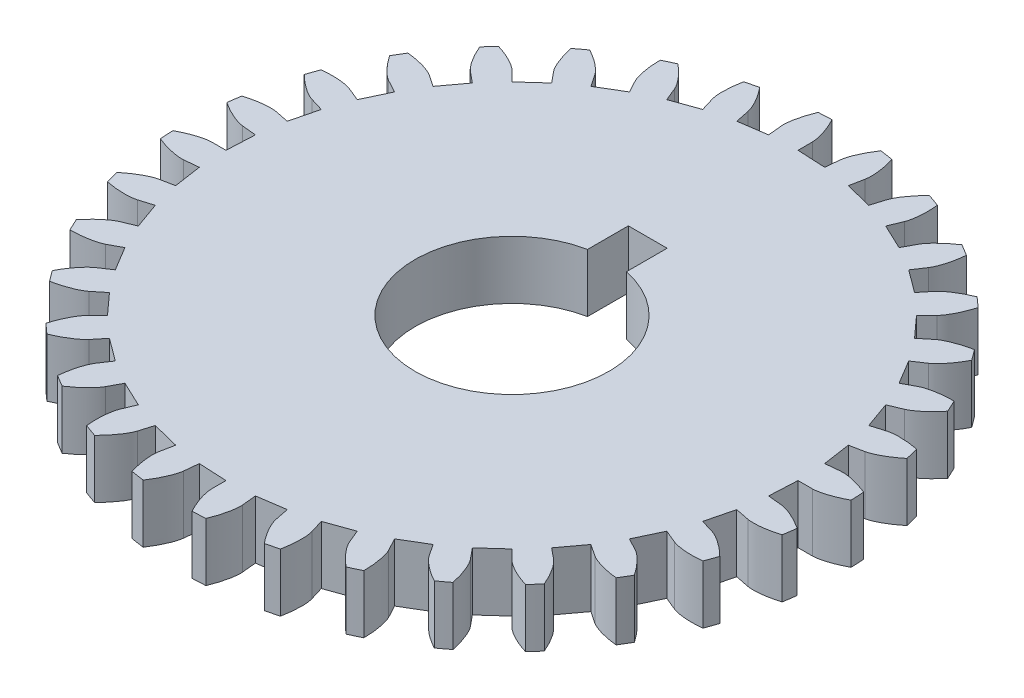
SolidWorks part; units mm, degrees
ref_plane "Front Plane" through (0, 0, 0) normal (0, 0, 1) x (1, 0, 0)
ref_plane "Top Plane" through (0, 0, 0) normal (0, 1, 0) x (1, 0, 0)
ref_plane "Right Plane" through (0, 0, 0) normal (1, 0, 0) x (0, 0, -1)
sketch "Sketch1" plane through (0, 0, 0) normal (0, 1, 0) x (1, 0, 0)
  line L0 (0, 0) -> (0, 7.7452) construction
  line L1 (0, 0) -> (-7.7452, 0) construction
  line L2 (0, 0) -> (-8.4898, -0.4171) construction
  line L3 (0, 0) -> (-7.7079, -0.7592) construction
  line L4 (0, 0) -> (-7.5964, -1.511) construction
  circle A0 centre (0, 0) radius 8 construction
  circle A1 centre (0, 0) radius 7.7452 construction
  circle A2 centre (0, 0) radius 7.375 construction
  circle A3 centre (0, 0) radius 8.5 construction
  spline S0 degree 4 poles (-7.7452, 0) (-7.7558, 0) (-7.7855, -0.0011) (-7.8414, -0.0075) (-7.9319, -0.0239) (-8.0454, -0.0537) (-8.1894, -0.1021) (-8.3547, -0.1717) (-8.5311, -0.2609) (-8.7164, -0.3713) (-8.8947, -0.493) (-9.0658, -0.6245) (-9.2299, -0.7647) (-9.4205, -0.9443) (-9.6374, -1.1739) (-9.8724, -1.4599) (-10.116, -1.8066) (-10.338, -2.1774) (-10.5345, -2.5612) (-10.7061, -2.9584) (-10.8534, -3.3625) (-10.9771, -3.779) (-11.0649, -4.1415) (-11.1265, -4.4669) (-11.168, -4.7213) (-11.1969, -4.9568) (-11.224, -5.1833) (-11.2488, -5.5647) (-11.2576, -5.8025) (-11.2587, -6.1731) (-11.2517, -6.3082) (-11.2484, -6.4164) knots 0 0 0 0 0 0.005377 0.015084 0.028532 0.04661 0.064855 0.092111 0.119476 0.146842 0.174209 0.201575 0.228941 0.256307 0.307035 0.361767 0.4165 0.471232 0.525964 0.580697 0.635429 0.690161 0.744894 0.77226 0.799626 0.826992 0.854358 0.909091 0.954545 1 1 1 1 1 construction
  spline S1 degree 4 poles (-7.7452, 0) (-7.7558, 0) (-7.7855, -0.0011) (-7.8414, -0.0075) (-7.9319, -0.0239) (-8.0454, -0.0537) (-8.1894, -0.1021) (-8.3547, -0.1717) (-8.5311, -0.2609) (-8.7164, -0.3713) (-8.8947, -0.493) (-9.0658, -0.6245) (-9.2299, -0.7647) (-9.4205, -0.9443) (-9.6374, -1.1739) (-9.8724, -1.4599) (-10.116, -1.8066) (-10.338, -2.1774) (-10.5345, -2.5612) (-10.7061, -2.9584) (-10.8534, -3.3625) (-10.9771, -3.779) (-11.0649, -4.1415) (-11.1265, -4.4669) (-11.168, -4.7213) (-11.1969, -4.9568) (-11.224, -5.1833) (-11.2415, -5.4528) (-11.2489, -5.5975) (-11.2521, -5.6955) knots 0 0 0 0 0 0.005377 0.015084 0.028532 0.04661 0.064855 0.092111 0.119476 0.146842 0.174209 0.201575 0.228941 0.256307 0.307035 0.361767 0.4165 0.471232 0.525964 0.580697 0.635429 0.690161 0.744894 0.77226 0.799626 0.826992 0.854358 0.909091 0.909091 0.909091 0.909091 0.909091
  dimension "D1" = 17
  dimension "D2" = 16
  dimension "D3" = 15.4904
  dimension "D4" = 14.75
  dimension "D5" = 7.7452
  dimension "D6" = 2.813
  dimension "D7" = 5.625
  dimension "D8" = 11.25
sketch "Sketch2" plane through (0, 0, 0) normal (0, 1, 0) x (1, 0, 0)
  line L0 (0, 0) -> (-8.4898, -0.4171) construction
  line L1 (0, 0) -> (-8.4898, -0.4171) construction
  line L2 (0, 0) -> (-7.7079, -0.7592) construction
  line L3 (0, 0) -> (-7.7452, 0) construction
  line L4 (0, 0) -> (-7.5964, -1.511) construction
  line L5 (0, 0) -> (-7.7079, -0.7592) construction
  line L6 (0, 0) -> (-7.7452, 0) construction
  line L7 (0, 0) -> (-7.5964, -1.511) construction
  line L8 (-7.7079, -0.7592) -> (-7.3395, -0.7229)
  line L9 (-7.3395, -0.7229) -> (-7.2333, -1.4388)
  line L10 (-7.2333, -1.4388) -> (-7.5964, -1.511) construction
  line L11 (-7.2333, -1.4388) -> (-2.452, -0.4877)
  line L12 (-7.7452, 0) -> (-2.5, 0)
  circle A0 centre (0, 0) radius 7.375 construction
  circle A1 centre (0, 0) radius 7.7452 construction
  circle A2 centre (0, 0) radius 8 construction
  circle A3 centre (0, 0) radius 8.5 construction
  circle A4 centre (0, 0) radius 7.375 construction
  circle A5 centre (0, 0) radius 7.7452 construction
  circle A6 centre (0, 0) radius 8 construction
  circle A7 centre (0, 0) radius 8.5 construction
  arc A8 (-8.4796, -0.5883) -> (-8.4964, -0.2457) centre (0, 0) cw
  circle A11 centre (0, 0) radius 2.5 construction
  arc A12 (-2.5, 0) -> (-2.452, -0.4877) centre (0, 0) ccw
  spline S0 degree 4 poles (-70.8844, -1998.7894) (-5.8416, -33.8641) (-5.9676, -0.6475) (-7.0092, 0.1439) (-7.9319, -0.0239) (-8.0454, -0.0537) (-8.1894, -0.1021) (-8.3547, -0.1717) (-8.5311, -0.2609) (-8.7164, -0.3713) (-8.8947, -0.493) (-9.0658, -0.6245) (-9.2299, -0.7647) (-9.4205, -0.9443) (-9.6374, -1.1739) (-9.8724, -1.4599) (-10.116, -1.8066) (-10.338, -2.1774) (-10.5345, -2.5612) (-10.7061, -2.9584) (-10.8534, -3.3625) (-10.9771, -3.779) (-11.0649, -4.1415) (-11.1265, -4.4669) (-11.168, -4.7213) (-11.1969, -4.9568) (-11.3662, -6.3731) (-11.2939, -12.7918) (-7.782, 75.5755) (-76.1929, -2004.4995) knots -0.42896 -0.42896 -0.42896 -0.42896 -0.42896 0.005377 0.015084 0.028532 0.04661 0.064855 0.092111 0.119476 0.146842 0.174209 0.201575 0.228941 0.256307 0.307035 0.361767 0.4165 0.471232 0.525964 0.580697 0.635429 0.690161 0.744894 0.77226 0.799626 0.826992 0.854358 1.627679 1.627679 1.627679 1.627679 1.627679 only from (-7.7452, 0) to (-11.2521, -5.6955) construction
  spline S1 degree 4 poles (-7.7452, 0) (-7.7558, 0) (-7.7855, -0.0011) (-7.8414, -0.0075) (-7.9319, -0.0239) (-8.0454, -0.0537) (-8.1894, -0.1021) (-8.3212, -0.1575) (-8.4178, -0.2043) (-8.4809, -0.2374) (-8.4964, -0.2457) knots 0 0 0 0 0 0.005377 0.015084 0.028532 0.04661 0.064855 0.092111 0.101035 0.101035 0.101035 0.101035 0.101035
  spline S2 degree 4 poles (-7.7079, -0.7592) (-7.7184, -0.7602) (-7.7481, -0.762) (-7.8044, -0.7612) (-7.896, -0.7537) (-8.0119, -0.7352) (-8.1599, -0.7011) (-8.2966, -0.6588) (-8.3973, -0.6218) (-8.4634, -0.595) (-8.4796, -0.5883) knots 0 0 0 0 0 0.005377 0.015084 0.028532 0.04661 0.064855 0.092111 0.101035 0.101035 0.101035 0.101035 0.101035
  point P21 (-7.3395, -0.7229)
  point P24 (-7.2333, -1.4388)
  dimension "D2" = 5
extrude "Boss-Extrude1" add sketch "Sketch2" along normal blind 1.5
pattern_circular "CirPattern1" count 32 over 360 of "Boss-Extrude1"
sketch "Sketch3" plane through (0, 1.5, 0) normal (0, 1, 0) x (1, 0, 0)
  line L1 (0.5, 1.5) -> (-0.5, 1.5)
  line L2 (0.5, 1.5) -> (0.5, 3.5)
  line L3 (0.5, 3.5) -> (-0.5, 3.5)
  line L4 (-0.5, 1.5) -> (-0.5, 3.5)
  line L5 (0.5, 1.5) -> (-0.5, 3.5) construction
  line L6 (0.5, 3.5) -> (-0.5, 1.5) construction
  circle A0 centre (0, 0) radius 2.5 construction
  point P0 (0, 2.5)
  dimension "D1" = 2
  dimension "D2" = 1
extrude "Cut-Extrude1" cut sketch "Sketch3" against normal up to surface (1.5 mm away)
equation "\"Module\"= .5"
equation "\"Number of Teeth\"= 32"
equation "\"Pressure Angle\"= 14.5deg"
equation "\"Pitch Diameter\"= \"Number of Teeth\" * \"Module\""
equation "\"Circular Pitch\"= pi * \"Module\""
equation "\"Addendum\"= \"Module\""
equation "\"Dedendum\"= 1.25 * \"Module\""
equation "\"Base Diameter\"= \"Pitch Diameter\" * cos ( \"Pressure Angle\" )"
equation "\"Base Radius\"= \"Base Diameter\" / 2"
equation "\"Width\"= 1.5"
equation "\"Outside Diameter\"= \"Pitch Diameter\" + 2 * \"Addendum\""
equation "\"D1@Sketch1\"=\"Outside Diameter\""
equation "\"D3@Sketch1\"=\"Base Diameter\""
equation "\"Root Diameter\"= \"Pitch Diameter\" - 2 * \"Dedendum\""
equation "\"D4@Sketch1\"=\"Root Diameter\""
equation "\"Tooth Angle\"= 360 / \"Number of Teeth\""
equation "\"D6@Sketch1\"=\"Tooth Angle\"/4"
equation "\"D7@Sketch1\"=\"Tooth Angle\"/2"
equation "\"D8@Sketch1\"=\"Tooth Angle\""
equation "\"D2@Sketch1\" = \"Pitch Diameter\""
equation "\"Shaft Diameter\" = 5"
equation "\"D1@CirPattern1\" = \"Number of Teeth\""
equation "\"D2@Sketch2\"= \"Shaft Diameter\""
equation "\"D1@Boss-Extrude1\" = \"Width\""
